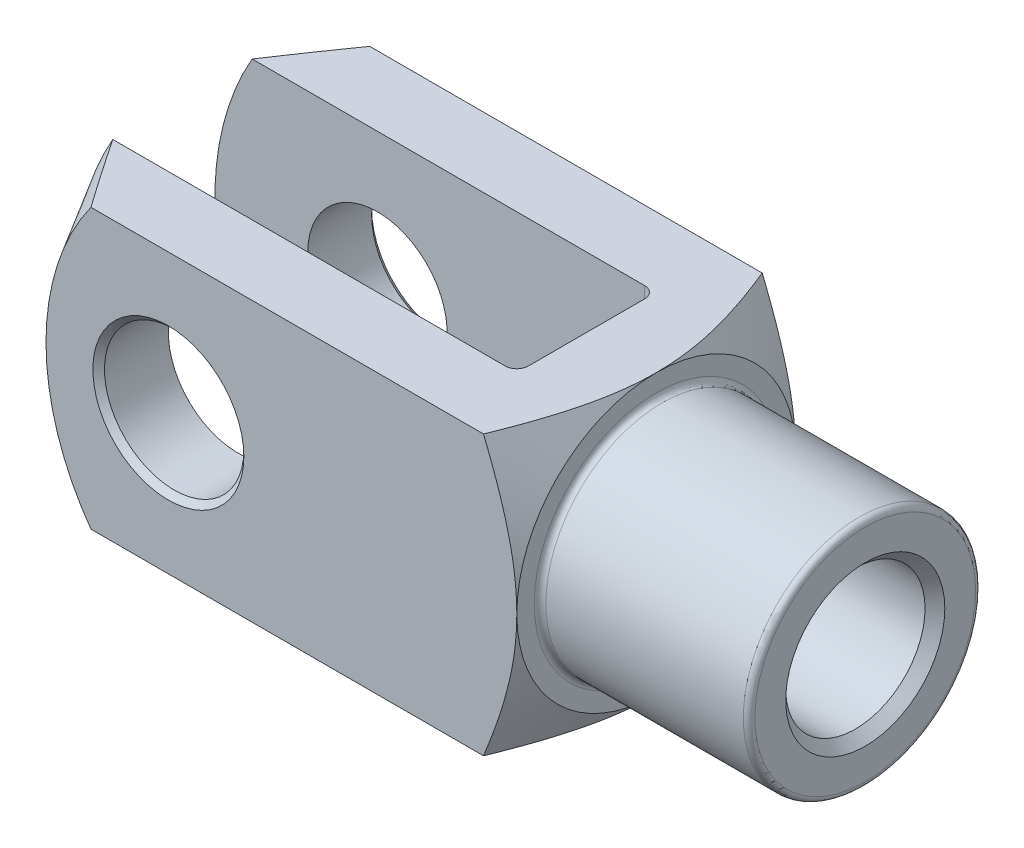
SolidWorks part; units mm, degrees
ref_plane "Front Plane" through (0, 0, 0) normal (0, 0, 1) x (1, 0, 0)
ref_plane "Top Plane" through (0, 0, 0) normal (0, 1, 0) x (1, 0, 0)
ref_plane "Right Plane" through (0, 0, 0) normal (1, 0, 0) x (0, 0, -1)
sketch "Sketch1" plane through (0, 0, 0) normal (1, 0, 0) x (0, 0, -1)
  line L0 (0, 0) -> (0, 50000) construction
  line L1 (0, 0) -> (50000, 0) construction
  line L2 (-12, -12) -> (-12, 12)
  line L3 (-12, 12) -> (12, 12)
  line L4 (12, -12) -> (12, 12)
  line L5 (-12, -12) -> (12, -12)
  point P9 (0, 12)
  point P11 (12, 0)
  point P12 (-12, 0)
  dimension "D1" = 24
  dimension "D2" = 24
extrude "Extrude1" add sketch "Sketch1" against normal blind 62
sketch "Sketch2" plane through (0, 0, 0) normal (1, 0, 0) x (0, 0, -1)
  circle A0 centre (0, 0) radius 10
  circle A1 centre (0, 0) radius 20
  dimension "D1" = 20
  dimension "D2" = 40
extrude "Extrude2" cut sketch "Sketch2" against normal blind 18
sketch "Sketch3" plane through (0, 0, 12) normal (0, 0, 1) x (1, 0, 0)
  circle A0 centre (-48, 0) radius 6
  dimension "D1" = 12
  dimension "D2" = 48
extrude "Extrude3" cut sketch "Sketch3" against normal through all
sketch "Sketch4" plane through (0, 12, 0) normal (0, 1, 0) x (1, 0, 0)
  line L0 (0, 0) -> (-50000, 0) construction
  line L1 (-62, -6) -> (-62, 6)
  line L2 (-62, 12) -> (-62, -12) construction
  line L3 (-62, 6) -> (-24, 6)
  line L4 (-24, 6) -> (-24, -6)
  line L5 (-48, 12) -> (-48, -12) construction
  line L6 (-62, -6) -> (-24, -6)
  point P7 (-48, 0)
  point P13 (-24, 0)
  point P14 (-62, 0)
  dimension "D1" = 24
  dimension "D2" = 12
extrude "Extrude4" cut sketch "Sketch4" against normal through all
fillet "Fillet1" radius 1 2 edges at (-24, 0, 6) (-24, 0, -6)
fillet "Fillet2" radius 0.5 2 edges at (0, 0, -10) (-18, 0, -10)
chamfer "Chamfer2" distance 0.5 angle 45 2 edges at (-42, 0, -12) (-42, 0, 12)
sketch "Sketch6" plane through (0, 0, 0) normal (0, 0, 1) x (1, 0, 0)
  line L0 (-18, -12) -> (-18, -24)
  line L1 (-18, -24) -> (-24.9282, -24)
  line L2 (-24.9282, -24) -> (-18, -12)
  dimension "D1" = 30
  dimension "D2" = 24
revolve "Cut-Revolve1" cut sketch "Sketch6" angle 360 about axis through (-18, 0, 0) along (1, 0, 0)
sketch "Sketch7" plane through (0, 0, 0) normal (0, 1, 0) x (1, 0, 0)
  line L0 (-58.5359, -12) -> (-62, -6)
  line L1 (-62, 6) -> (-58.5359, 12)
  line L2 (-58.5359, 12) -> (-86, 12)
  line L3 (-62, 6) -> (-62, -6)
  line L4 (-86, 12) -> (-86, -12)
  line L5 (-86, -12) -> (-58.5359, -12)
  line L6 (-62, 12) -> (-20.8698, 12) construction
  line L7 (-62, -12) -> (-20.8698, -12) construction
  line L8 (-38, 0.6162) -> (-38, 50000.6162) construction
  dimension "D1" = 120
  dimension "D2" = 24
  dimension "D3" = 24
revolve "Cut-Revolve2" cut sketch "Sketch7" angle 180 about L8
sketch "Sketch8" plane through (0, 0, 0) normal (1, 0, 0) x (0, 0, -1)
  circle A0 centre (0, 0) radius 6
  dimension "D1" = 12
extrude "Extrude5" cut sketch "Sketch8" against normal through all
chamfer "Chamfer3" distance 0.85 angle 45 1 edges at (0, 0, -6)
equation "\"D2@Sketch1\" = \"D1@Sketch1\""
equation "\"D2@Sketch2\" = \"D1@Sketch2\"*2"
equation "\"D2@Sketch6\" = \"D1@Sketch1\""
equation "\"D2@Sketch7\" = \"D1@Sketch1\""
equation "\"D3@Sketch7\" = \"D1@Sketch1\""
